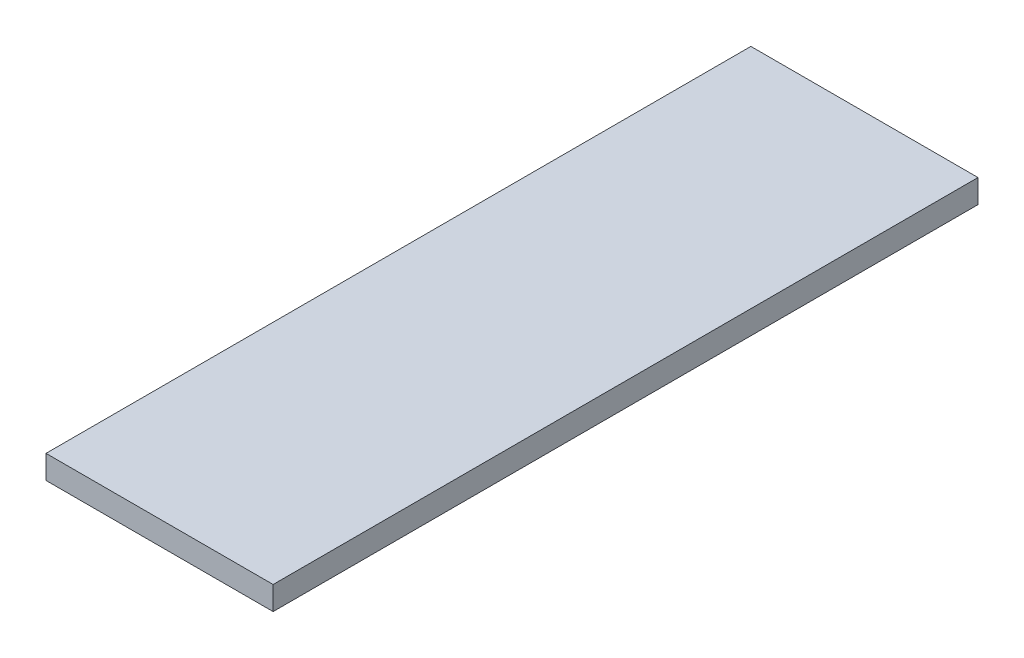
SolidWorks part; units mm, degrees
ref_plane "FRONT" through (0, 0, 0) normal (0, 0, 1) x (1, 0, 0)
ref_plane "TOP" through (0, 0, 0) normal (0, 1, 0) x (1, 0, 0)
ref_plane "RIGHT" through (0, 0, 0) normal (1, 0, 0) x (0, 0, -1)
sketch "Sketch1" plane through (0, 0, 0) normal (0, 1, 0) x (1, 0, 0)
  line L1 (-23.0188, 71.4375) -> (23.0187, 71.4375)
  line L2 (-23.0188, 71.4375) -> (-23.0187, -71.4375)
  line L3 (-23.0187, -71.4375) -> (23.0188, -71.4375)
  line L4 (23.0187, 71.4375) -> (23.0188, -71.4375)
  line L5 (-23.0188, 71.4375) -> (23.0188, -71.4375) construction
  line L6 (-23.0187, -71.4375) -> (23.0187, 71.4375) construction
  point P0 (0, 0)
  dimension "D1" = 46.0375
  dimension "D2" = 142.875
extrude "Boss-Extrude1" add sketch "Sketch1" along normal blind 4.7625
